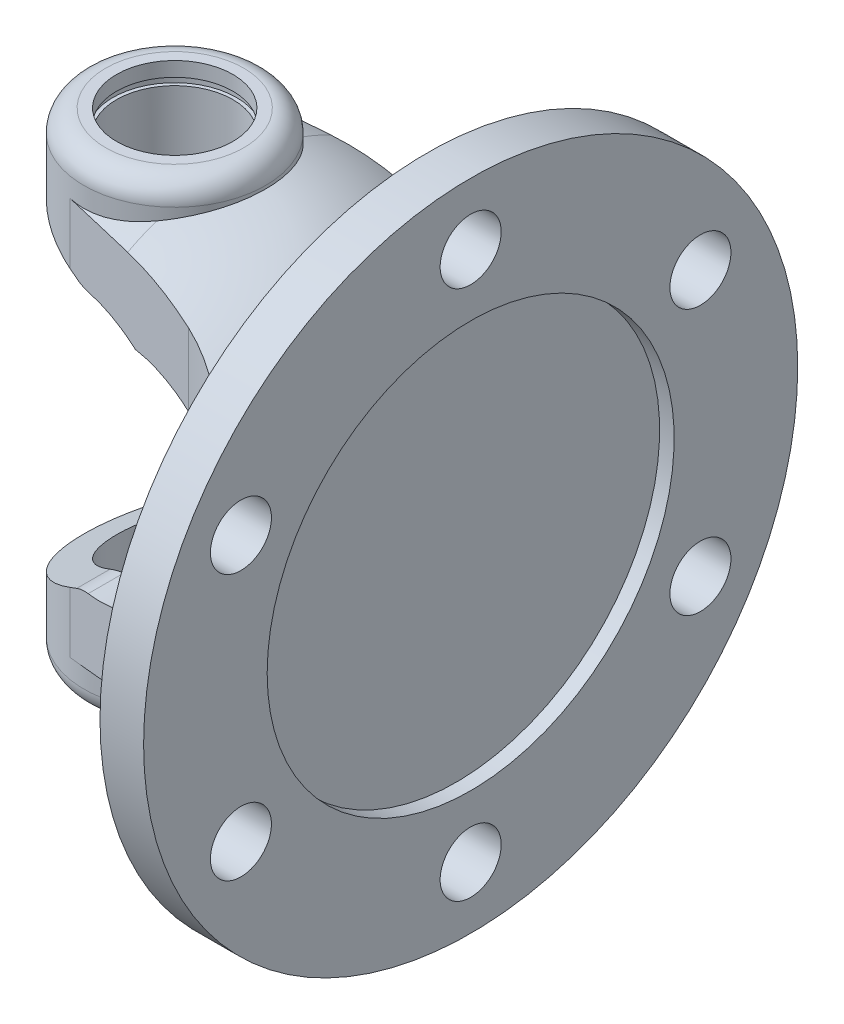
SolidWorks part; units mm, degrees
ref_plane "Front Plane" through (0, 0, 0) normal (0, 0, 1) x (1, 0, 0)
ref_plane "Top Plane" through (0, 0, 0) normal (0, 1, 0) x (1, 0, 0)
ref_plane "Right Plane" through (0, 0, 0) normal (1, 0, 0) x (0, 0, -1)
sketch "Sketch1" plane through (0, 0, 0) normal (0, 0, 1) x (1, 0, 0)
  line L0 (-12.5, 0) -> (38.7164, 0)
  line L1 (38.7164, 0) -> (38.7164, 28)
  line L2 (38.7164, 28) -> (40.7164, 28)
  line L3 (7.5, 30) -> (-12.5, 30)
  line L4 (-12.5, 30) -> (-12.5, 0)
  line L5 (40.7164, 28) -> (40.7164, 45)
  line L6 (40.7164, 45) -> (34.7164, 45)
  line L7 (30.7164, 19) -> (34.7164, 19)
  line L8 (34.7164, 19) -> (34.7164, 45)
  arc A0 (30.7164, 19) -> (7.5, 30) centre (7.5, 0) ccw
  dimension "D3" = 30
  dimension "D4" = 45
  dimension "D2" = 30
  dimension "D5" = 12.5
  dimension "D6" = 20
  dimension "D7" = 6
  dimension "D8" = 2
  dimension "D9" = 28
  dimension "D10" = 4
  dimension "D11" = 19
revolve "Revolve1" add sketch "Sketch1" angle 360 about L0
sketch "Sketch2" plane through (0, 0, 0) normal (0, 1, 0) x (1, 0, 0)
  line L0 (28.5, -21.4243) -> (28.5, -41.4243)
  line L1 (28.5, -21.4243) -> (25.0936, -24.7633) construction
  line L2 (28.5, -21.4243) -> (29.6509, -22.5985) construction
  line L3 (-12.5, 0) -> (41.0657, 0) construction
  line L4 (-12.5, 30) -> (-12.5, -30) construction
  line L5 (-2.1199, -12.3189) -> (17.609, -15.714)
  line L6 (-2.1199, 12.3189) -> (17.609, 15.714)
  line L7 (28.5, -41.4243) -> (-41.5, -41.4243)
  line L8 (-41.5, -41.4243) -> (-41.5, 41.4243)
  line L9 (-41.5, 41.4243) -> (28.5, 41.4243)
  line L10 (28.5, 41.4243) -> (28.5, 21.4243)
  arc A0 (-2.1199, 12.3189) -> (-2.1199, -12.3189) centre (0, 0) ccw
  arc A2 (17.609, -15.714) -> (28.5, -21.4243) centre (14.2171, -35.4243) cw
  arc A3 (7.5, -30) -> (30.7164, -19) centre (7.5, 0) ccw construction
  arc A4 (7.5, -30) -> (30.7164, -19) centre (7.5, 0) ccw construction
  arc A5 (7.5, -30) -> (30.7164, -19) centre (7.5, 0) ccw construction
  arc A6 (17.609, 15.714) -> (28.5, 21.4243) centre (14.2171, 35.4243) ccw
  dimension "D1" = 25
  dimension "D2" = 20
  dimension "D3" = 20
  dimension "D4" = 70
  dimension "D5" = 41
extrude "Cut-Extrude1" cut sketch "Sketch2" against normal through all both and the other way through all
sketch "Sketch3" plane through (0, 0, 0) normal (0, 0, 1) x (1, 0, 0)
  line L0 (-12.5, 24) -> (0, 18)
  line L1 (-12.5, 30) -> (-12.5, -30) construction
  line L4 (0, 18) -> (0, -18)
  line L5 (24, 0) -> (0, 0) construction
  line L7 (-12.5, -24) -> (0, -18)
  line L9 (-12.5, 24) -> (-12.5, -24)
  dimension "D1" = 12.5
  dimension "D3" = 6
  dimension "D4" = 12
extrude "Cut-Extrude2" cut sketch "Sketch3" against normal through all both and the other way through all
sketch "Sketch7" plane through (0, 0, 0) normal (1, 0, 0) x (0, 0, -1)
  line L0 (0, 0) -> (0, 43.6765) construction
  line L1 (-20, 18) -> (-8, 18)
  line L2 (12.6837, 18) -> (-12.6837, 18) construction
  line L5 (20, 18) -> (8, 18)
  line L6 (-20, 18) -> (-20, 0)
  line L8 (-20, 0) -> (20, 0)
  line L9 (20, 0) -> (20, 18)
  arc A0 (8, 18) -> (-8, 18) centre (0, 0) ccw
  dimension "D1" = 16
  dimension "D3" = 40
revolve "Cut-Revolve2" cut sketch "Sketch7" angle 360 about L8
fillet "Fillet1" radius 5 4 edges at (0, -18, -10.3419) (0, -18, 10.3419) (0, 18, -10.3419) (0, 18, 10.3419)
sketch "Sketch4" plane through (0, 0, 0) normal (0, 0, 1) x (1, 0, 0)
  line L0 (-9.5, 33) -> (0, 33)
  line L1 (0, 33) -> (0, 24)
  line L2 (0, 24) -> (-12.5, 24)
  line L3 (-12.5, 30) -> (-12.5, 24) construction
  line L4 (-12.5, 24) -> (-12.5, 30)
  line L5 (7.5, 30) -> (-12.5, 30) construction
  arc A0 (-12.5, 30) -> (-9.5, 33) centre (-9.5, 30) cw
  dimension "D1" = 3
revolve "Revolve2" add sketch "Sketch4" angle 360 about L1
mirror "Mirror1" about plane through (0, 0, 0) normal (0, 1, 0) of "Revolve2"
sketch "Sketch5" plane through (0, 33, 0) normal (0, 1, 0) x (1, 0, 0)
  circle A0 centre (0, 0) radius 8
  dimension "D1" = 16
extrude "Cut-Extrude3" cut sketch "Sketch5" against normal through all
sketch "Sketch6" plane through (0, 0, 0) normal (0, 0, 1) x (1, 0, 0)
  line L0 (8, 31) -> (8.5, 31)
  line L1 (8.5, 31) -> (8.5, 30)
  line L2 (8.5, 30) -> (8, 30)
  line L3 (8, 30) -> (8, 31)
  line L4 (0, 0) -> (0, 47.1154) construction
  line L5 (9.5, 33) -> (-9.5, 33) construction
  line L7 (0, 0) -> (51.1336, 0) construction
  line L8 (8, -30) -> (8, -31)
  line L9 (8.5, -30) -> (8, -30)
  line L10 (8.5, -31) -> (8.5, -30)
  line L11 (8, -31) -> (8.5, -31)
  dimension "D1" = 8
  dimension "D2" = 2
  dimension "D3" = 1
  dimension "D4" = 0.5
revolve "Cut-Revolve1" cut sketch "Sketch6" angle 360 about L4
sketch "Sketch8" plane through (0, 0, 0) normal (0, 1, 0) x (1, 0, 0)
  line L0 (19.374, 3.5567) -> (6.3836, 11.0567)
  line L1 (-11.0329, -19.1096) -> (22.7452, 39.3958) construction
  line L4 (6.3836, 11.0567) -> (14.5636, 25.2249)
  line L5 (14.5636, 25.2249) -> (25.5, 18.9107)
  line L6 (0, 0) -> (0, 51.0803) construction
  line L7 (18, 15.7853) -> (18, 8)
  line L8 (18, 15.7853) -> (18, 8) construction
  arc A0 (19.374, 3.5567) -> (25.5, 18.9107) centre (5.5215, 17.9827) ccw
  arc A1 (18, 15.7853) -> (28.5, 21.4243) centre (14.2171, 35.4243) ccw
  arc A2 (18, 15.7853) -> (28.5, 21.4243) centre (14.2171, 35.4243) ccw construction
  arc A3 (18, -8) -> (18, 8) centre (0, 0) ccw
  arc A4 (18, -8) -> (18, 8) centre (0, 0) ccw construction
  point P15 (25.5, 18.9107)
  dimension "D1" = 15
  dimension "D4" = 3
  dimension "D2" = 30
  dimension "D3" = 20
revolve "Cut-Revolve3" cut sketch "Sketch8" angle 360 about L1
mirror "Mirror2" about plane through (0, 0, 0) normal (0, 0, 1) of "Cut-Revolve3"
hole_wizard "M8 Clearance Hole1" positions "Sketch11" profile "Sketch10" hole size "M8" standard "DIN"
sketch "Sketch11" plane through (40.7164, 0, 0) normal (1, 0, 0) x (0, 0, -1)
  line L0 (0, 28) -> (0, 45) construction
  circle A0 centre (0, 0) radius 28 construction
  circle A1 centre (0, 0) radius 28 construction
  circle A2 centre (0, 0) radius 45 construction
  point P0 (0, 36.5)
sketch "Sketch10" plane through (40.7164, 36.5, 0) normal (0, 1, 0) x (0, 0, -1)
  line L0 (0, 0) -> (0, 6.001)
  line L1 (0, 6.001) -> (4.2, 6.001)
  line L2 (4.2, 6.001) -> (4.2, 0)
  line L5 (4.2, 0) -> (0, 0)
  line L11 (0, -6.35) -> (0, 107.95) construction
  dimension "Thru Hole Dia." = 8.4
  dimension "Thru Hole Depth" = 6.001
pattern_circular "CirPattern1" count 6 over 360 about axis through (0, 0, 0) along (1, 0, 0) of "M8 Clearance Hole1"
chamfer "Chamfer1" distance 1.5 angle 45 1 edges at (34.7164, 0, 19)
